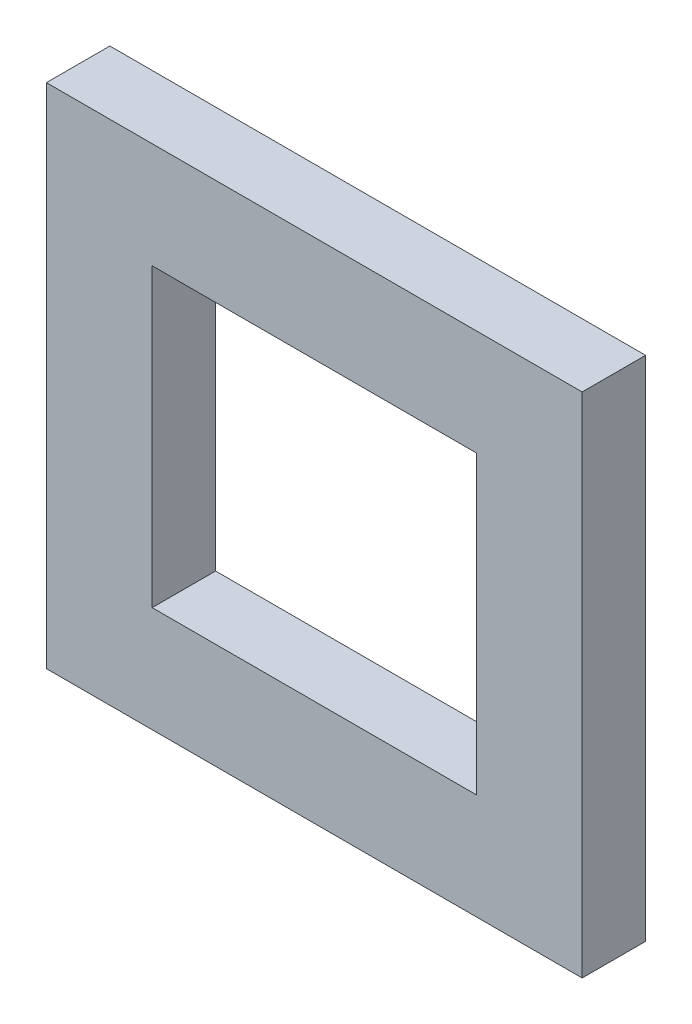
SolidWorks part; units mm, degrees
ref_plane "Front Plane" through (0, 0, 0) normal (0, 0, 1) x (1, 0, 0)
ref_plane "Top Plane" through (0, 0, 0) normal (0, 1, 0) x (1, 0, 0)
ref_plane "Right Plane" through (0, 0, 0) normal (1, 0, 0) x (0, 0, -1)
sketch "Sketch1" plane through (0, 0, 0) normal (0, 0, 1) x (1, 0, 0)
  line L0 (-120.65, 114.3) -> (120.65, 114.3)
  line L1 (-76.2, 69.85) -> (76.2, 69.85) construction
  line L2 (-76.2, 69.85) -> (-76.2, -69.85) construction
  line L3 (-76.2, -69.85) -> (76.2, -69.85) construction
  line L4 (76.2, 69.85) -> (76.2, -69.85) construction
  line L5 (-76.2, 69.85) -> (76.2, -69.85) construction
  line L6 (-76.2, -69.85) -> (76.2, 69.85) construction
  line L7 (120.65, 114.3) -> (120.65, -114.3)
  line L8 (-120.65, -114.3) -> (120.65, -114.3)
  line L9 (-120.65, 114.3) -> (-120.65, -114.3)
  line L10 (-73.025, 66.675) -> (-73.025, -66.675)
  line L11 (-73.025, -66.675) -> (73.025, -66.675)
  line L12 (73.025, 66.675) -> (73.025, -66.675)
  line L13 (-73.025, 66.675) -> (73.025, 66.675)
  point P0 (0, 0)
  dimension "D1" = 152.4
  dimension "D2" = 139.7
  dimension "D3" = 44.45
  dimension "D4" = 3.175
extrude "Boss-Extrude1" add sketch "Sketch1" along normal blind 28.575
sketch "Sketch4" plane through (-73.025, 0, 0) normal (1, 0, 0) x (0, 0, -1)
  line L4 (0, 66.675) -> (0, -66.675) construction
  circle A0 centre (-19.05, -58.7248) radius 1.0922
  dimension "D3" = 2.1844
  dimension "D1" = 7.9502
  dimension "D2" = 19.05
extrude "Cut-Extrude1" [suppressed] cut sketch "Sketch4" against normal blind 9.5758
pattern_linear "LPattern1" [suppressed] count 2 spacing 117.4496
mirror "Mirror1" [suppressed] about plane through (0, 0, 0) normal (1, 0, 0)
sketch "Sketch5" plane through (0, 66.675, 0) normal (0, -1, 0) x (1, 0, 0)
  line L2 (-73.025, 28.575) -> (-73.025, 0) construction
  line L3 (73.025, 0) -> (-73.025, 0) construction
  circle A0 centre (-65.0748, 19.05) radius 1.0922
  dimension "D2" = 19.05
  dimension "D3" = 2.1844
  dimension "D1" = 7.9502
extrude "Cut-Extrude2" [suppressed] cut sketch "Sketch5" against normal blind 9.5758
pattern_linear "LPattern2" [suppressed] count 2 spacing 130.1496
mirror "Mirror2" [suppressed] about plane through (0, 0, 0) normal (0, 1, 0)
